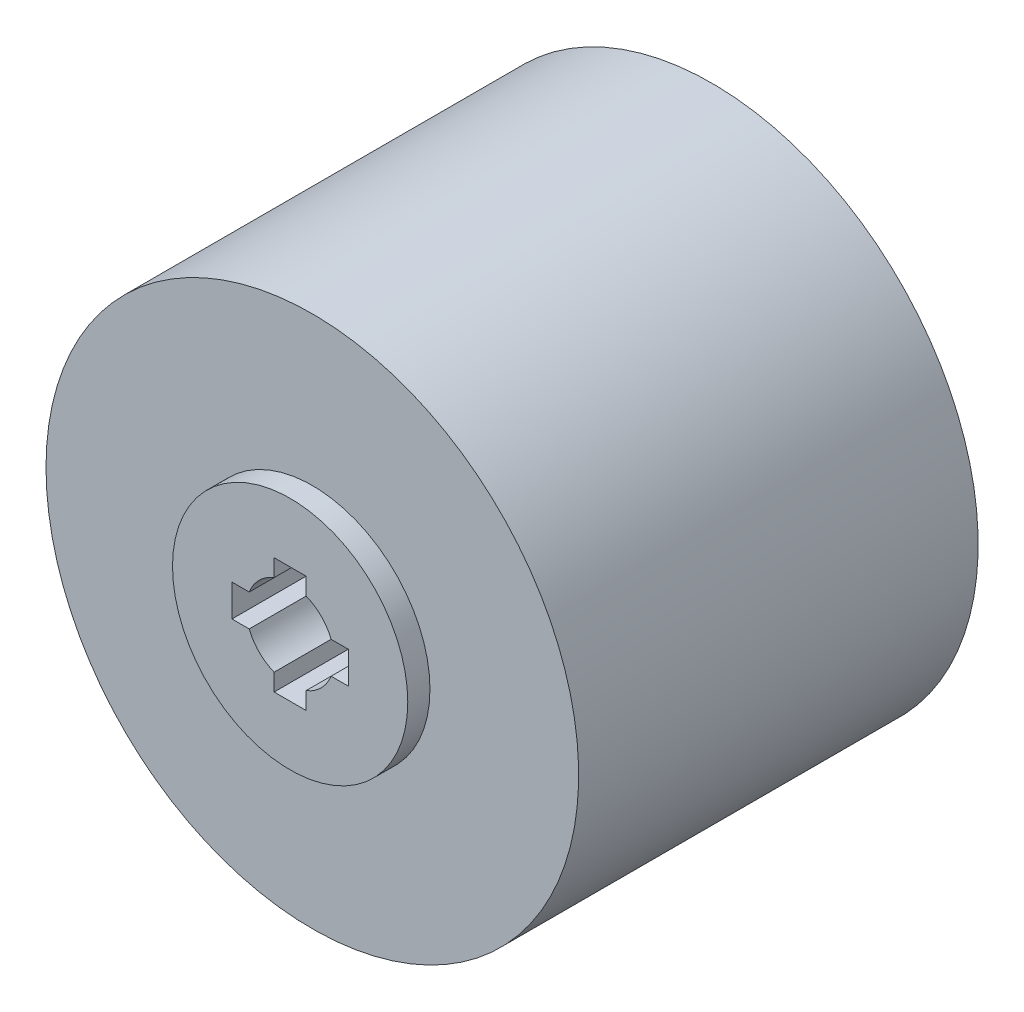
SolidWorks part; units mm, degrees
ref_plane "Plan de face" through (0, 0, 0) normal (0, 0, 1) x (1, 0, 0)
ref_plane "Plan de dessus" through (0, 0, 0) normal (0, 1, 0) x (1, 0, 0)
ref_plane "Plan de droite" through (0, 0, 0) normal (1, 0, 0) x (0, 0, -1)
sketch "Esquisse1" plane through (0, 0, 0) normal (0, 0, 1) x (1, 0, 0)
  circle A0 centre (0, 0) radius 26.5
  dimension "D1" = 53
extrude "Boss.-Extru.1" add sketch "Esquisse1" along normal blind 50
sketch "Esquisse3" plane through (0, 0, 0) normal (0, 0, -1) x (-1, 0, 0)
  circle A0 centre (0, 0) radius 60
  dimension "D1" = 120
extrude "Boss.-Extru.2" add sketch "Esquisse3" against normal blind 45
mirror "Symétrie1" of "Boss.-Extru.2", "Boss.-Extru.1"
sketch "Esquisse4" plane through (0, 0, 50) normal (0, 0, 1) x (1, 0, 0)
  line L1 (-13.1, 3.6) -> (13.1, 3.6)
  line L2 (-13.1, 3.6) -> (-13.1, -3.6)
  line L3 (-13.1, -3.6) -> (13.1, -3.6)
  line L4 (13.1, 3.6) -> (13.1, -3.6)
  line L5 (-3.6, 13.1) -> (3.6, 13.1)
  line L6 (-3.6, 13.1) -> (-3.6, -13.1)
  line L7 (-3.6, -13.1) -> (3.6, -13.1)
  line L8 (3.6, 13.1) -> (3.6, -13.1)
  circle A0 centre (0, 0) radius 9.9
  point P11 (0, 13.1)
  point P12 (13.1, 0)
  point P15 (-3.6, 0)
  point P16 (-13.1, 0)
  point P17 (0, 3.6)
  dimension "D1" = 19.8
  dimension "D2" = 7.2
  dimension "D3" = 26.2
extrude "Enlèv. mat.-Extru.1" cut sketch "Esquisse4" against normal through all contours A0 | L6 L5 L8 L7 | L2 L1 L4 L3
